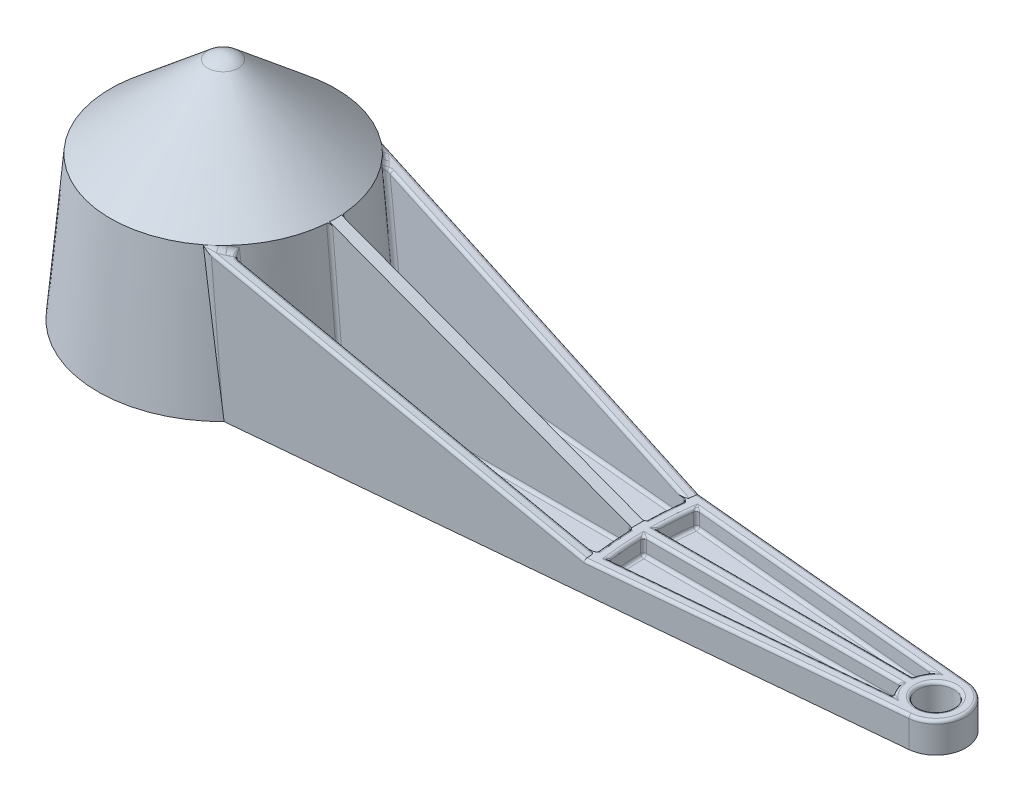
SolidWorks part; units mm, degrees
ref_plane "Ebene vorne" through (0, 0, 0) normal (0, 0, 1) x (1, 0, 0)
ref_plane "Ebene oben" through (0, 0, 0) normal (0, 1, 0) x (1, 0, 0)
ref_plane "Ebene rechts" through (0, 0, 0) normal (1, 0, 0) x (0, 0, -1)
sketch "Skizze1" plane through (0, 0, 0) normal (0, 0, 1) x (1, 0, 0)
  line L3 (18, 0) -> (16, 22.5744)
  line L4 (16, 22.5744) -> (0, 36)
  line L5 (0, 38.6946) -> (0, 36)
  line L6 (0, 39.208) -> (0, -16.9438) construction
  line L7 (18, 0) -> (21.0118, 0)
  line L8 (21.0118, 0) -> (18.8788, 24.075)
  line L9 (18.8788, 24.075) -> (2.5712, 37.7588)
  arc A1 (2.5712, 37.7588) -> (0, 38.6946) centre (0, 34.6946) ccw
  dimension "D5" = 3
  dimension "D6" = 4
  dimension "D1" = 36
  dimension "D2" = 32
  dimension "D3" = 3
  dimension "D4" = 36
  dimension "D7" = 50
revolve "Rotation1" add sketch "Skizze1" angle 360 about L5
ref_plane "Ebene1" through (0, 4, 0) normal (0, -1, 0) x (-1, 0, 0)
other "Schneiden4"
delete or keep bodies "Körper-Löschen/beibehalten 1" type delete bodies bodies 110
sketch "Skizze3" plane through (0, 0, 0) normal (0, 0, 1) x (1, 0, 0)
  line L0 (-23.1129, 4) -> (23.1129, 4) construction
  line L1 (18, 0) -> (16, 22.5744) construction
  line L2 (0, 0) -> (0, 14.8717) construction
  circle A0 centre (17.746, 4) radius 0.5
  dimension "D1" = 1
  dimension "D2" = 0.1
revolve "Schnitt-Rotation1" cut sketch "Skizze3" angle 360 about L2
fillet "Verrundung1" radius 0.5 2 edges at (-17.6896, 3.5032, 0) (17.6032, 4.4792, 0)
sketch "Skizze6" plane through (0, 0, 0) normal (0, -1, 0) x (1, 0, 0)
  line L0 (12.4783, 15) -> (119.9759, 4.9784)
  line L1 (119.9759, -4.9784) -> (12.4783, -15)
  line L2 (12.4783, 15) -> (12.4783, -15) construction
  line L3 (19.5118, 0) -> (119.5118, 0) construction
  arc A1 (119.9759, 4.9784) -> (119.9759, -4.9784) centre (119.5118, 0) cw
  arc A2 (12.4783, 15) -> (12.4783, -15) centre (0, 0) cw
  circle A3 centre (0, 0) radius 21.0118 construction
  dimension "D1" = 30
  dimension "D2" = 1.5
  dimension "D3" = 5
  dimension "D4" = 100
extrude "Aufsatz-Linear austragen1" add sketch "Skizze6" against normal blind 2
sketch "Skizze7" plane through (1.4939, 0, 16.024) normal (0.0928, 0, 0.9957) x (0.9957, 0, -0.0928)
  line L1 (-18.8788, 24.075) -> (18.8788, 24.075) construction
  line L2 (10.1523, 24.075) -> (13.2317, 2)
  line L3 (13.2317, 2) -> (118.9958, 2)
  line L4 (118.9958, 2) -> (118.9958, 5)
  line L5 (118.9958, 5) -> (68.9958, 5)
  line L6 (68.9958, 5) -> (10.1523, 24.075)
  arc A0 (13.509, 0) -> (13.2317, 2) centre (-1184.894, -165.1313) ccw construction
  dimension "D1" = 3
  dimension "D2" = 50
extrude "Aufsatz-Linear austragen2" add sketch "Skizze7" against normal blind 2
mirror "Spiegeln1" about plane through (0, 0, 0) normal (0, 0, 1) of "Aufsatz-Linear austragen2"
sketch "Skizze8" plane through (0, 2, 0) normal (0, 1, 0) x (1, 0, 0)
  line L0 (16.5864, -12.6083) -> (119.7902, -2.987) construction
  circle A0 centre (119.5118, 0) radius 5
  arc A1 (119.9759, -4.9784) -> (119.9759, 4.9784) centre (119.5118, 0) ccw construction
  circle A2 centre (119.5118, 0) radius 3
extrude "Aufsatz-Linear austragen3" add sketch "Skizze8" along normal up to surface (3 mm away)
sketch "Skizze10" plane through (0, 0, 0) normal (0, 0, 1) x (1, 0, 0)
  line L0 (69.5118, 5) -> (18.8788, 24.075)
  line L1 (69.5118, 5) -> (114.5118, 5)
  dimension "D1" = 45
rib "Verstärkungsrippe5" sketch "Skizze10" sketch "Skizze10" thickness 2 extrusion direction parallel to sketch draft on no parameters "D1"=2
sketch "Skizze11" plane through (0, 5, 0) normal (0, 1, 0) x (1, 0, 0)
  line L0 (69.5118, 1) -> (69.5118, -1) construction
  arc A0 (70.0061, 7.6282) -> (70.0061, -7.6282) centre (128.6147, 0) ccw
rib "Verstärkungsrippe6" sketch "Skizze11" sketch "Skizze11" thickness 2 parameters "D1"=2
fillet "Verrundung15" radius 0.5 4 edges
fillet "Verrundung10" radius 0.5 35 edges at (115.0514, 2, 2.2596) (115.0514, 5, -2.2596) (93.0666, 2, -1) (93.0666, 2, 1) (93.9031, 2, 5.4004) (43.8445, 2, -10.0672) (71.9941, 2, -7.4063) (71.9941, 2, 7.4063) (71.9941, 5, 7.4063) (69.6699, 5, 4.321) (69.6699, 5, -4.321) (71.9941, 5, -7.4063) (71.6658, 2, 4.1916) (71.6658, 5, 4.1916) (69.6699, 2, 4.321) (69.6699, 2, -4.321) (71.6658, 2, -4.1916) (71.6658, 5, -4.1916) (45.402, 2, -1) (19.6822, 2, -6.833) (20.9139, 2, -1.1619) (17.2344, 2, -12.3094) (15.9827, 12.731, -11.8289) (19.6822, 2, 6.833) (20.6945, 2.9961, 1.4648) (45.402, 2, 1) (43.8445, 2, 10.0672) (17.1755, 2, 12.2092) (20.9692, 2, 1.1103) (16.4294, 12.7751, 12.623) (93.9031, 2, -5.4004) (122.5118, 5, 0) (115.0514, 2, -2.2596) (115.0514, 5, 2.2596)
fillet "Verrundung13" radius 0.5 36 edges at (69.4561, 2.2531, 1.0652) (69.6298, 4.8123, 1) (69.4561, 2.2531, -1.0652) (69.7079, 4.8904, -1) (69.5202, 3.5, 1) (69.5202, 3.5, -1) (70.1151, 4.8122, -7.6181) (69.9354, 2.2573, -7.5717) (70.1929, 4.8903, 7.6108) (69.9354, 2.2573, 7.5717) (70.0061, 3.5, -7.6282) (70.0061, 3.5, 7.6282) (114.6725, 4.7597, 0.9273) (114.553, 2.2388, 1.0736) (115.7462, 2.3305, 3.3343) (115.9763, 4.7704, 3.4224) (114.6725, 4.7597, -0.9273) (114.553, 2.2388, -1.0736) (115.9763, 4.7704, -3.4224) (115.7462, 2.3305, -3.3343) (72.167, 2.1047, 7.2321) (71.8718, 4.8536, 7.6014) (71.5853, 2.256, -1.0636) (71.4557, 4.7442, -0.9363) (71.5853, 2.256, 1.0636) (71.4557, 4.7442, 0.9363) (72.167, 2.1047, -7.2321) (71.8718, 4.8536, -7.6014) (114.6128, 3.5, 1) (115.8075, 3.5, 3.3583) (114.6128, 3.5, -1) (115.8075, 3.5, -3.3583) (71.9988, 3.5, 7.4425) (71.5205, 3.5, -1) (71.5205, 3.5, 1) (71.9988, 3.5, -7.4425)
fillet "Verrundung16" radius 0.5 9 edges at (13.261, 23.4924, 13.5095) (11.5942, 24.075, 14.9936) (95.0838, 5, 7.299) (40.8971, 14.5375, 12.3506) (11.5942, 24.075, -14.9936) (95.0838, 5, -7.299) (13.261, 23.4924, -13.5095) (40.8971, 14.5375, -12.3506) (124.5118, 5, 0)
fillet "Verrundung19" radius 5 3 edges at (13.1736, 12.7623, 14.9352) (11.6426, 23.7547, -15.0319) (13.1736, 12.7623, -14.9352)
fillet "Verrundung20" radius 1 4 edges at (11.8532, 23.9585, 14.7072) (13.4812, 23.415, 13.2995) (11.6744, 23.9577, -14.8496) (13.4812, 23.415, -13.2995)
fillet "Verrundung21" radius 0.5 6 edges at (14.6361, 23.2055, 12.369) (14.6361, 23.2055, -12.369) (15.1588, 22.8566, -12.7385) (42.454, 13.9702, 10.1968) (42.454, 13.9702, -10.1968)
chamfer "Fase2" distance 2.5 angle 30 1 edges at (-18, 0, 0)
fillet "Verrundung22" radius 1 1 edges at (-17.7794, 2.4902, 0)
delete or keep bodies "Körper-Löschen/beibehalten 2" type delete bodies bodies 109
sketch "Skizze12" plane through (0, 2, 0) normal (0, 1, 0) x (1, 0, 0)
  circle A1 centre (119.5118, 0) radius 3
  circle A2 centre (119.5118, 0) radius 3
  dimension "D1" = 0
extrude "Schnitt-Linear austragen1" cut sketch "Skizze12" against normal through all
fillet "Verrundung23" radius 0.5 1 edges at (116.5118, 0, 0)
